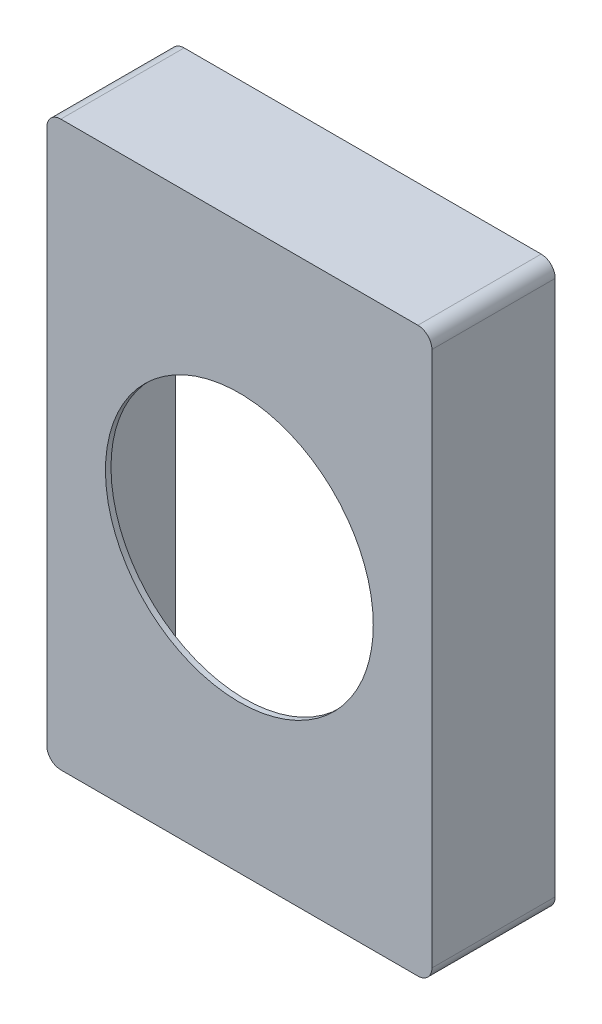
SolidWorks part; units mm, degrees
ref_plane "Plan de face" through (0, 0, 0) normal (0, 0, 1) x (1, 0, 0)
ref_plane "Plan de dessus" through (0, 0, 0) normal (0, 1, 0) x (1, 0, 0)
ref_plane "Plan de droite" through (0, 0, 0) normal (1, 0, 0) x (0, 0, -1)
sketch "Esquisse1" plane through (0, 0, 0) normal (0, 0, 1) x (1, 0, 0)
  circle A0 centre (0, 0) radius 28
  circle A1 centre (0, 0) radius 31
  dimension "D1" = 56
  dimension "D2" = 62
extrude "Boss.-Extru.1" add sketch "Esquisse1" along normal blind 7.5
sketch "Esquisse22" plane through (0, 0, 7.5) normal (0, 0, 1) x (1, 0, 0)
  line L0 (23.9165, -2) -> (27.9285, -2)
  line L1 (14.2859, 19.2851) -> (16.6669, 22.4992)
  line L2 (2, 23.9165) -> (2, 27.9285)
  line L3 (19.2851, -14.2859) -> (22.4992, -16.6669)
  line L4 (-2, -27.9285) -> (-2, -23.9165)
  line L5 (-23.9165, 2) -> (-27.9285, 2)
  line L6 (-16.6669, -22.4992) -> (-14.2859, -19.2851)
  line L7 (-19.2851, 14.2859) -> (-22.4992, 16.6669)
  circle A0 centre (0, 0) radius 24
  circle A1 centre (0, 0) radius 28
extrude "Boss.-Extru.9" add sketch "Esquisse22" against normal blind 2.75 contours A0 L7 L5 M4 | A0 L1 L2 M4 | A0 L3 L0 M4 | A0 L6 L4 M4
sketch "Esquisse23" plane through (0, 0, 7.5) normal (0, 0, 1) x (1, 0, 0)
  line L0 (0.0921, -23.9998) -> (0.4417, -27.9965)
  line L1 (-23.9998, -0.0921) -> (-27.9965, -0.4417)
  line L2 (-0.0921, 23.9998) -> (-0.4417, 27.9965)
  line L3 (23.9998, 0.0921) -> (27.9965, 0.4417)
  line L4 (2, 27.9285) -> (2, 23.9165)
  line L6 (23.9165, -2) -> (27.9285, -2)
  line L7 (-2, -27.9285) -> (-2, -23.9165)
  line L9 (-23.9165, 2) -> (-27.9285, 2)
  circle A0 centre (0, 0) radius 28
  circle A1 centre (0, 0) radius 24
  point P17 (0, 0)
  dimension "D1" = 56
  dimension "D2" = 4.012
  dimension "D3" = 4
extrude "Boss.-Extru.10" add sketch "Esquisse23" against normal up to surface (7.5 mm away) contours A1 L1 M7 M6 | A1 L2 M11 M10 | A1 L3 M15 M14 | A1 L0 M19 M18
sketch "Esquisse24" plane through (0, 0, 0) normal (0, 0, -1) x (-1, 0, 0)
  circle A0 centre (0, 0) radius 28
extrude "Boss.-Extru.11" add sketch "Esquisse24" against normal blind 1.3
sketch "Esquisse25" plane through (0, 0, 7.5) normal (0, 0, 1) x (1, 0, 0)
  line L0 (-31, 0) -> (31, 0)
  line L6 (-44, 65) -> (44, 65)
  line L7 (31, 0) -> (0, 31)
  line L8 (0, 31) -> (0, -31)
  line L9 (-44, 65) -> (-44, -65)
  line L10 (-44, -65) -> (44, -65)
  line L11 (44, 65) -> (44, -65)
  line L12 (-44, 65) -> (44, -65) construction
  line L13 (-44, -65) -> (44, 65) construction
  circle A1 centre (0, 0) radius 31 construction
  circle A2 centre (0, 0) radius 31
  point P0 (0, 0)
  dimension "D1" = 130
  dimension "D2" = 88
extrude "Boss.-Extru.12" add sketch "Esquisse25" against normal blind 1.3 contours L11 L6 L9 L10 M27
sketch "Esquisse26" plane through (0, 0, 7.5) normal (0, 0, 1) x (1, 0, 0)
  line L0 (-45.3, 66.3) -> (-45.3, -66.3)
  line L1 (-44, 65) -> (44, 65)
  line L2 (-44, 65) -> (-44, -65)
  line L3 (-44, -65) -> (44, -65)
  line L4 (44, 65) -> (44, -65)
  line L5 (-45.3, -66.3) -> (45.3, -66.3)
  line L6 (45.3, 66.3) -> (45.3, -66.3)
  line L7 (-45.3, 66.3) -> (45.3, 66.3)
  dimension "D1" = 1.3
extrude "Boss.-Extru.13" add sketch "Esquisse26" against normal blind 29
sketch "Esquisse27" plane through (0, 0, 0) normal (0, 0, -1) x (-1, 0, 0)
  line L10 (0, 73.962) -> (0, -91.3935) construction
  line L11 (-39, 60) -> (39, -60)
  line L12 (39, 60) -> (-39, -60)
  line L13 (-39, -60) -> (39, -60)
  line L14 (-39, 60) -> (-39, -60)
  line L15 (39, 60) -> (-39, 60)
  line L16 (39, -60) -> (39, 60)
  line L17 (-8.5, 2) -> (-19.5, 2)
  line L18 (-8.5, 30) -> (-8.5, 2)
  line L19 (-19.5, 30) -> (-8.5, 30)
  line L20 (-19.5, 2) -> (-19.5, 30)
  circle A47 centre (33, -51) radius 3
  circle A48 centre (21.275, -48) radius 0.45
  circle A49 centre (18.735, -48) radius 0.45
  circle A50 centre (26.17, -38.04) radius 0.6
  circle A51 centre (26.18, -32.95) radius 0.6
  circle A52 centre (12.8, -48) radius 0.5
  circle A53 centre (5.2, -48) radius 0.5
  circle A54 centre (13.84, -38.04) radius 0.6
  circle A55 centre (13.83, -32.96) radius 0.6
  circle A56 centre (4.17, -38.04) radius 0.6
  circle A57 centre (4.18, -32.95) radius 0.6
  circle A58 centre (26.51, -15.99) radius 0.5
  circle A59 centre (26.51, -13.45) radius 0.5
  circle A60 centre (26.51, -10.91) radius 0.5
  circle A61 centre (26.51, -8.37) radius 0.5
  circle A62 centre (26.51, -5.83) radius 0.5
  circle A63 centre (26.51, -3.29) radius 0.5
  circle A64 centre (26.51, -0.75) radius 0.5
  circle A65 centre (-0.725, -48) radius 0.45
  circle A66 centre (-3.265, -48) radius 0.45
  circle A67 centre (-8.16, -38.04) radius 0.6
  circle A68 centre (-8.17, -32.96) radius 0.6
  circle A69 centre (-17.83, -38.04) radius 0.6
  circle A70 centre (-17.82, -32.95) radius 0.6
  circle A71 centre (-22.725, -48) radius 0.45
  circle A72 centre (-25.265, -48) radius 0.45
  circle A73 centre (-33, -54.5) radius 3
  circle A74 centre (-30.16, -38.04) radius 0.6
  circle A75 centre (-30.17, -32.96) radius 0.6
  circle A76 centre (-32, -8.5) radius 3
  circle A77 centre (26.51, 1.79) radius 0.5
  circle A78 centre (31, 26.68) radius 0.5
  circle A79 centre (31, 29.22) radius 0.5
  circle A80 centre (31, 31.76) radius 0.5
  circle A81 centre (31, 34.3) radius 0.5
  circle A82 centre (31, 36.84) radius 0.5
  circle A83 centre (31, 39.38) radius 0.5
  circle A84 centre (31, 41.92) radius 0.5
  circle A85 centre (31, 44.46) radius 0.5
  circle A86 centre (31, 47) radius 0.5
  circle A87 centre (33.5, 55) radius 3
  circle A88 centre (-32.52, 31.76) radius 0.5
  circle A89 centre (-32.52, 34.3) radius 0.5
  circle A90 centre (-32.52, 36.84) radius 0.5
  circle A91 centre (-32.52, 39.38) radius 0.5
  circle A92 centre (-32.52, 41.92) radius 0.5
  circle A93 centre (-31, 52) radius 3
sketch "Esquisse34" plane through (0, 0, 0) normal (0, 0, -1) x (-1, 0, 0)
  circle A0 centre (0, 0) radius 31.5
  dimension "D1" = 63
extrude "Enlèv. mat.-Extru.2" cut sketch "Esquisse34" against normal blind 8.5
sketch "Esquisse28" plane through (0, 0, 6.2) normal (0, 0, -1) x (-1, 0, 0)
  circle A0 centre (-33, -54.5) radius 5
  circle A1 centre (33, -51) radius 5
  circle A2 centre (33.5, 55) radius 5
  circle A3 centre (-31, 52) radius 5
  circle A4 centre (-32, -8.5) radius 5
  dimension "D1" = 10
  dimension "D2" = 10
  dimension "D3" = 10
  dimension "D4" = 10
  dimension "D5" = 10
extrude "Boss.-Extru.14" add sketch "Esquisse28" along normal blind 15
sketch "Esquisse29" plane through (0, 0, -8.8) normal (0, 0, -1) x (-1, 0, 0)
  circle A0 centre (-33, -54.5) radius 2.5
  circle A1 centre (33, -51) radius 2.5
  circle A2 centre (-32, -8.5) radius 2.5
  circle A3 centre (-31, 52) radius 2.5
  circle A4 centre (33.5, 55) radius 2.5
  dimension "D1" = 5
  dimension "D2" = 5
  dimension "D3" = 5
  dimension "D4" = 5
  dimension "D5" = 5
extrude "Boss.-Extru.15" add sketch "Esquisse29" along normal blind 3
fillet "Congé1" radius 2 4 edges at (-44, 65, -7.65) (-44, -65, -7.65) (44, -65, -7.65) (44, 65, -7.65)
fillet "Congé2" radius 3.3 4 edges at (-45.3, 66.3, -7) (-45.3, -66.3, -7) (45.3, -66.3, -7) (45.3, 66.3, -7)
sketch "Esquisse35" plane through (0, 0, 7.5) normal (0, 0, 1) x (1, 0, 0)
  circle A0 centre (0, 0) radius 31.5
  circle A1 centre (32, -8.5) radius 5
extrude "Enlèv. mat.-Extru.3" cut sketch "Esquisse35" against normal blind 8.5 contours A1 M1
